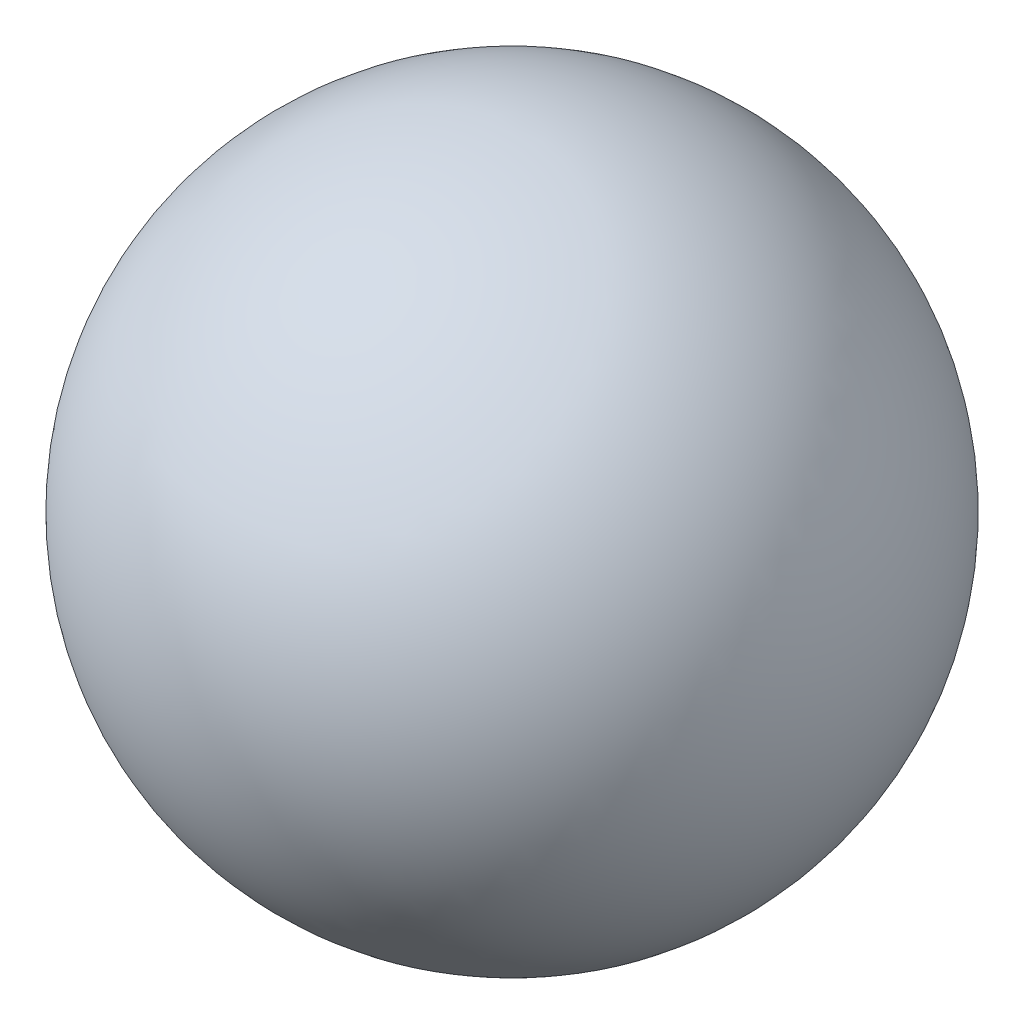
SolidWorks part; units mm, degrees
ref_plane "Alzado" through (0, 0, 0) normal (0, 0, 1) x (1, 0, 0)
ref_plane "Planta" through (0, 0, 0) normal (0, 1, 0) x (1, 0, 0)
ref_plane "Vista lateral" through (0, 0, 0) normal (1, 0, 0) x (0, 0, -1)
sketch "Croquis1" plane through (0, 0, 0) normal (0, 0, 1) x (1, 0, 0)
  line L0 (0, 27.5162) -> (0, -21.1663) construction
  line L1 (0, -15) -> (0, 15)
  arc A0 (0, 15) -> (0, -15) centre (0, 0) ccw
  dimension "D1" = 30
revolve "Revolución1" add sketch "Croquis1" angle 360 about L0
ref_plane "Plano de Choque" through (0, 0, 20) normal (0, 0, 1) x (1, 0, 0)
